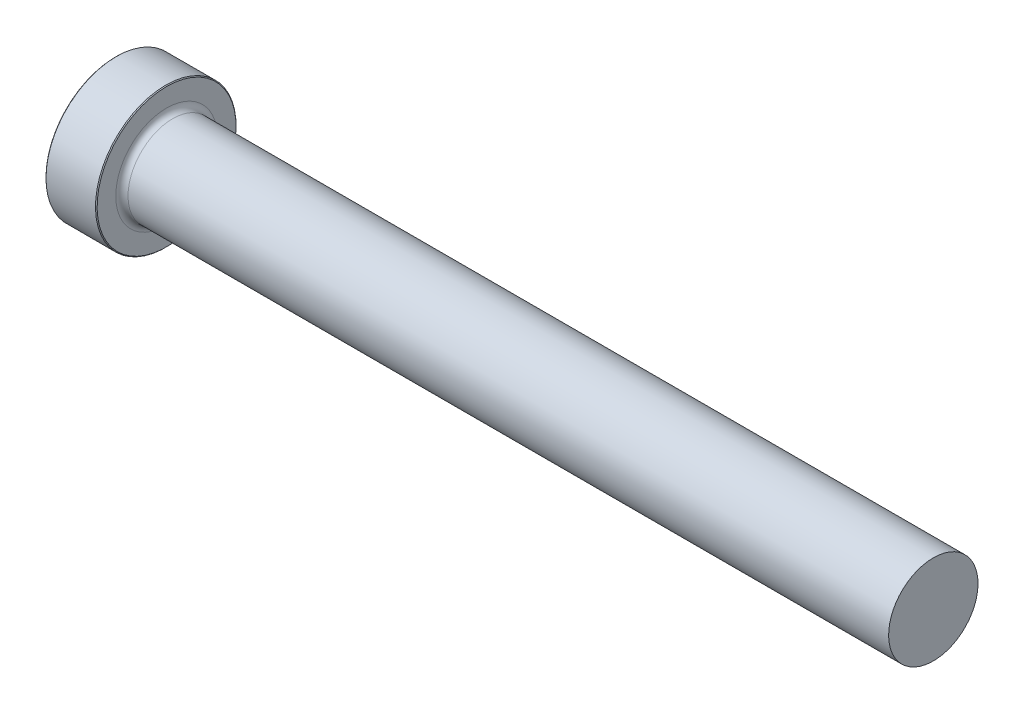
SolidWorks part; units mm, degrees
ref_plane "Front Plane" through (0, 0, 0) normal (0, 0, 1) x (1, 0, 0)
ref_plane "Top Plane" through (0, 0, 0) normal (0, 1, 0) x (1, 0, 0)
ref_plane "Right Plane" through (0, 0, 0) normal (1, 0, 0) x (0, 0, -1)
sketch "Sketch1" plane through (0, 0, 0) normal (0, 0, 1) x (1, 0, 0)
  line L0 (0, 0) -> (0, 8.7312)
  line L1 (0, 8.7312) -> (6.35, 8.7312)
  line L2 (6.35, 8.7312) -> (6.35, 6.3144)
  line L3 (7.112, 5.5524) -> (101.6, 5.5524)
  line L4 (101.6, 5.5524) -> (101.6, 0)
  line L5 (101.6, 0) -> (0, 0)
  line L6 (101.6, 0) -> (101.6, -5.5524) construction
  line L7 (101.6, -5.5524) -> (6.35, -5.5524) construction
  line L8 (0, 0) -> (0, -8.7312) construction
  line L9 (0, -8.7312) -> (6.35, -8.7312) construction
  line L10 (6.35, -8.7312) -> (6.35, -5.5524) construction
  arc A0 (6.35, 6.3144) -> (7.112, 5.5524) centre (7.112, 6.3144) ccw
  dimension "D4" = 0.762
  dimension "L" = 101.6
  dimension "D" = 11.1049
  dimension "H" = 17.4625
  dimension "T" = 6.35
revolve "Revolve1" add sketch "Sketch1" angle 360 about L5
chamfer "Chamfer1" distance 0.1016 angle 45 2 edges at (0, 8.7312, 0) (6.35, 8.7313, 0)
